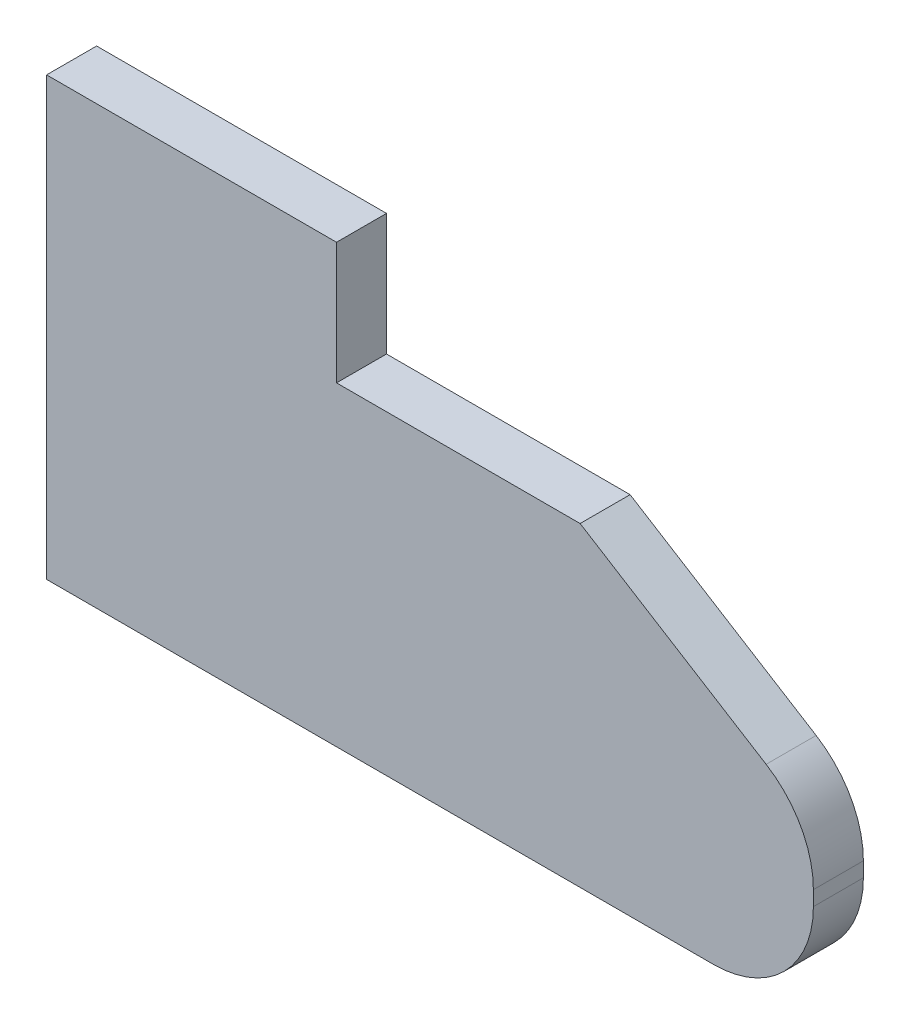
SolidWorks part; units mm, degrees
ref_plane "Front Plane" through (0, 0, 0) normal (0, 0, 1) x (1, 0, 0)
ref_plane "Top Plane" through (0, 0, 0) normal (0, 1, 0) x (1, 0, 0)
ref_plane "Right Plane" through (0, 0, 0) normal (1, 0, 0) x (0, 0, -1)
sketch "Sketch1" plane through (0, 0, 0) normal (0, 0, 1) x (1, 0, 0)
  line L0 (28.9899, 43.6956) -> (28.9899, 31.5169)
  line L1 (0, 0) -> (66.6774, 0)
  line L2 (0, 0) -> (0, 43.6956)
  line L3 (0, 43.6956) -> (28.9899, 43.6956)
  line L4 (76.6774, 10) -> (76.6774, 11.4704)
  line L5 (28.9899, 31.5169) -> (53.351, 31.5169)
  line L6 (53.351, 31.5169) -> (71.9528, 19.9658)
  arc A0 (71.9528, 19.9658) -> (76.6774, 11.4704) centre (66.6774, 11.4704) cw
  arc A1 (66.6774, 0) -> (76.6774, 10) centre (66.6774, 10) ccw
  dimension "D1" = 10
extrude "Extrude1" add sketch "Sketch1" along normal blind 5
sketch "Sketch3" plane through (0, 0, 5) normal (0, 0, 1) x (1, 0, 0)
  line L4 (0, 43.6956) -> (0, 0)
  line L5 (0, 0) -> (66.6774, 0)
  line L6 (76.6774, 10) -> (76.6774, 11.4704)
  line L7 (28.9899, 43.6956) -> (0, 43.6956)
  line L8 (0, 43.6956) -> (0, 0)
  line L9 (0, 0) -> (66.6774, 0)
  line L10 (76.6774, 10) -> (76.6774, 11.4704)
  line L11 (28.9899, 43.6956) -> (0, 43.6956)
  line L15 (71.9528, 19.9658) -> (53.351, 31.5169)
  line L16 (71.9528, 19.9658) -> (53.351, 31.5169)
  line L17 (53.351, 31.5169) -> (28.9899, 31.5169)
  line L18 (53.351, 31.5169) -> (28.9899, 31.5169)
  line L19 (28.9899, 31.5169) -> (28.9899, 43.6956)
  line L20 (28.9899, 31.5169) -> (28.9899, 43.6956)
  arc A2 (66.6774, 0) -> (76.6774, 10) centre (66.6774, 10) ccw
  arc A3 (66.6774, 0) -> (76.6774, 10) centre (66.6774, 10) ccw
  arc A4 (76.6774, 11.4704) -> (71.9528, 19.9658) centre (66.6774, 11.4704) ccw
  arc A5 (76.6774, 11.4704) -> (71.9528, 19.9658) centre (66.6774, 11.4704) ccw
  dimension "D1" = 0
